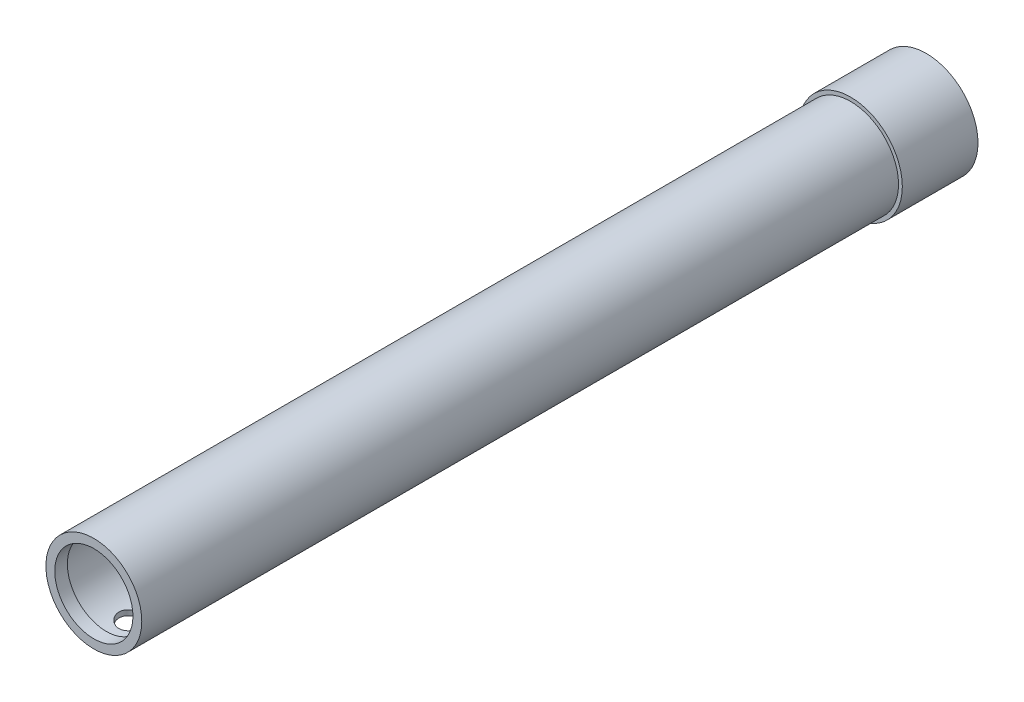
SolidWorks part; units mm, degrees
ref_plane "Front Plane" through (0, 0, 0) normal (0, 0, 1) x (1, 0, 0)
ref_plane "Top Plane" through (0, 0, 0) normal (0, 1, 0) x (1, 0, 0)
ref_plane "Right Plane" through (0, 0, 0) normal (1, 0, 0) x (0, 0, -1)
sketch "Sketch2" plane through (0, 0, 0) normal (0, 0, 1) x (1, 0, 0)
  circle A0 centre (0, 0) radius 19
  dimension "D1" = 38
extrude "Boss-Extrude1" add sketch "Sketch2" along normal blind 300
sketch "Sketch3" plane through (0, 0, 0) normal (0, 0, 1) x (1, 0, 0)
  circle A0 centre (0, 0) radius 20.5
  dimension "D1" = 41
extrude "Boss-Extrude2" add sketch "Sketch3" against normal blind 30
sketch "Sketch4" plane through (0, 0, 300) normal (0, 0, 1) x (1, 0, 0)
  circle A0 centre (0, 0) radius 17
  dimension "D1" = 34
extrude "Cut-Extrude1" cut sketch "Sketch4" against normal blind 300
sketch "Sketch5" plane through (0, 0, 300) normal (0, 0, 1) x (1, 0, 0)
  circle A0 centre (0, 0) radius 19
  circle A1 centre (0, 0) radius 15.5
  dimension "D1" = 38
  dimension "D2" = 31
extrude "Boss-Extrude3" add sketch "Sketch5" against normal blind 5
sketch "Sketch6" plane through (0, 0, 0) normal (0, 1, 0) x (1, 0, 0)
  line L0 (-19, -300) -> (19, -300) construction
  circle A0 centre (0, -285) radius 5
  dimension "D2" = 10
  dimension "D1" = 15
extrude "Cut-Extrude2" cut sketch "Sketch6" against normal through all contours A0
sketch "Sketch7" plane through (0, 0, -30) normal (0, 0, -1) x (-1, 0, 0)
  circle A0 centre (0, 0) radius 17.25
  dimension "D1" = 34.5
extrude "Cut-Extrude3" cut sketch "Sketch7" against normal up to surface (30 mm away)
